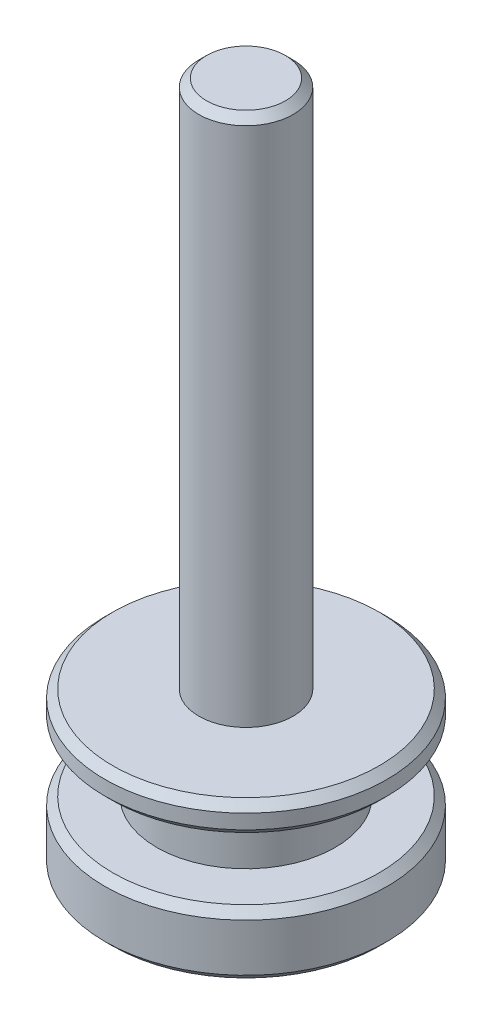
SolidWorks part; units mm, degrees
ref_plane "Front Plane" through (0, 0, 0) normal (0, 0, 1) x (1, 0, 0)
ref_plane "Top Plane" through (0, 0, 0) normal (0, 1, 0) x (1, 0, 0)
ref_plane "Right Plane" through (0, 0, 0) normal (1, 0, 0) x (0, 0, -1)
sketch "Sketch1" plane through (0, 0, 0) normal (0, 1, 0) x (1, 0, 0)
  circle A0 centre (0, 0) radius 7.112
  dimension "D1" = 14.224
extrude "Boss-Extrude1" add sketch "Sketch1" along normal blind 3.2004
sketch "Sketch2" plane through (0, 3.2004, 0) normal (0, 1, 0) x (1, 0, 0)
  circle A0 centre (0, 0) radius 4.5
  dimension "D1" = 9
extrude "Boss-Extrude2" add sketch "Sketch2" along normal blind 3.1496
sketch "Sketch3" plane through (0, 6.35, 0) normal (0, 1, 0) x (1, 0, 0)
  circle A0 centre (0, 0) radius 7.112
  dimension "D1" = 14.224
extrude "Boss-Extrude3" add sketch "Sketch3" along normal blind 1.524
sketch "Sketch4" plane through (0, 7.874, 0) normal (0, 1, 0) x (1, 0, 0)
  circle A0 centre (0, 0) radius 2.3813
  dimension "D1" = 4.7625
extrude "Boss-Extrude4" add sketch "Sketch4" along normal blind 26.67
chamfer "Chamfer1" distance 0.3969 angle 45 5 edges at (0, 34.544, 2.3813) (0, 0, 7.112) (0, 3.2004, 7.112) (0, 6.35, 7.112) (0, 7.874, 7.112)
